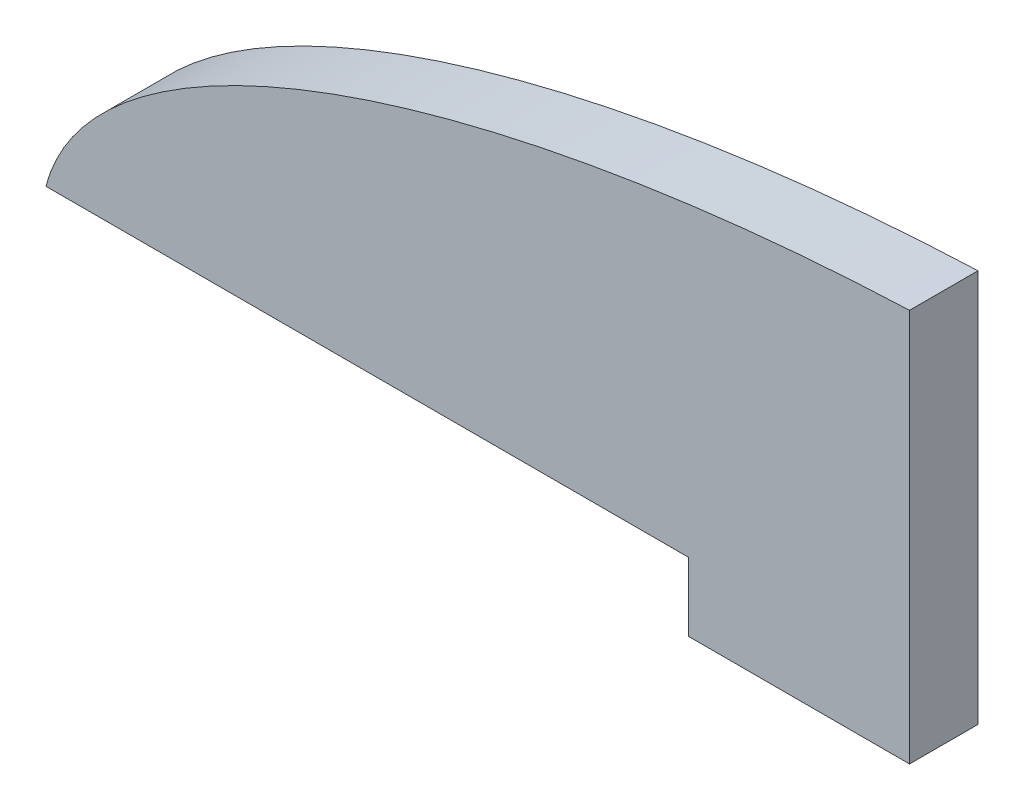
SolidWorks part; units mm, degrees
ref_plane "Front Plane" through (0, 0, 0) normal (0, 0, 1) x (1, 0, 0)
ref_plane "Top Plane" through (0, 0, 0) normal (0, 1, 0) x (1, 0, 0)
ref_plane "Right Plane" through (0, 0, 0) normal (1, 0, 0) x (0, 0, -1)
sketch "Sketch1" plane through (0, 0, 0) normal (0, 0, 1) x (1, 0, 0)
  line L0 (0, 0) -> (-4.7625, 0) construction
  line L1 (-4.7625, 0) -> (-4.7625, 16.6286)
  line L2 (-4.7625, 0) -> (-4.7625, -1.5875)
  line L3 (-4.7625, -1.5875) -> (-15, -1.5875)
  line L4 (-15, -1.5875) -> (-15, 1.5875)
  line L5 (-15, 1.5875) -> (-44.7968, 1.5875)
  ellipse E0 centre (0, 0) end of major axis (-45, 0) minor radius 20 construction
  ellipse E1 centre (0, 0) end of major axis (-45, 0) minor radius 16.7225 (-4.7625, 16.6286) -> (-44.7968, 1.5875) ccw
  point P6 (-4.7625, 22.8293)
  point P9 (-4.7625, 23.903)
  point P14 (-4.7625, 16.7225)
  dimension "D1" = 3.175
  dimension "D2" = 10.2375
  dimension "D3" = 1.5875
  dimension "D4" = 4.7625
extrude "Boss-Extrude1" add sketch "Sketch1" along normal blind 3.175
